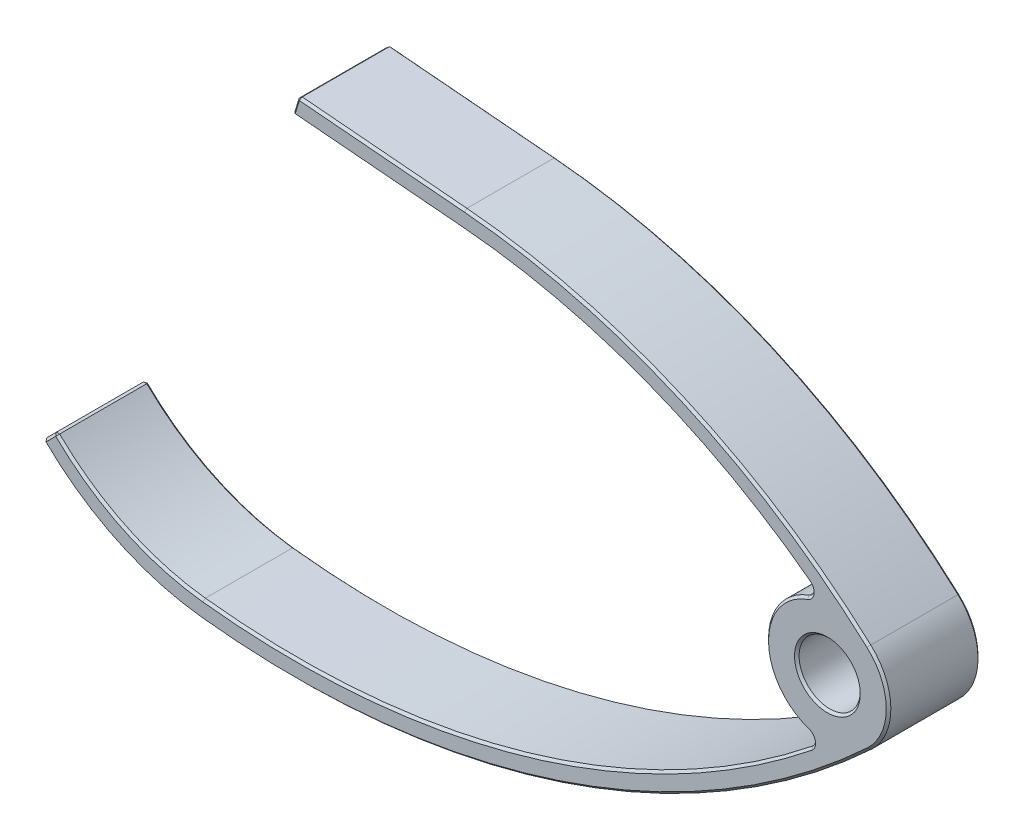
SolidWorks part; units mm, degrees
ref_plane "Спереди" through (0, 0, 0) normal (0, 0, 1) x (1, 0, 0)
ref_plane "Сверху" through (0, 0, 0) normal (0, 1, 0) x (1, 0, 0)
ref_plane "Справа" through (0, 0, 0) normal (1, 0, 0) x (0, 0, -1)
sketch "Эскиз1" plane through (0, 0, 0) normal (0, 0, 1) x (1, 0, 0)
  line L0 (-11.4704, -11.5105) -> (-12.3175, -12.3605)
  line L1 (0, 0) -> (0, -24.7511) construction
  line L2 (4, 14.2504) -> (15.1724, 13.2926)
  line L3 (-12.3175, 0) -> (51.0777, 0) construction
  line L4 (4, 14.2504) -> (4.3545, 15.4244)
  line L5 (5.5763, 15.3197) -> (17.995, 14.255) construction
  line L6 (4.3545, 15.4244) -> (15.2749, 14.4882)
  line L7 (5.5763, 15.3197) -> (5.808, 16.0869) construction
  line L8 (4, 14.2504) -> (4.6592, 16.4337) construction
  line L9 (0, 0) -> (4, 14.2504) construction
  line L10 (19.0603, 12.7831) -> (19.0603, 12.7831)
  line L11 (19.0603, 12.7831) -> (19.0603, 12.7831)
  line L12 (19.0603, 12.7831) -> (19.0603, 12.7831)
  line L13 (4, 14.2504) -> (17.8925, 13.0594) construction
  arc A0 (-11.4704, -11.5105) -> (-1.8309, -16.1465) centre (0, 0) ccw
  circle A1 centre (39, 0) radius 2
  arc A2 (41.727, -2.9263) -> (41.6896, 2.9607) centre (39, 0) ccw
  arc A3 (-1.9661, -17.3389) -> (41.727, -2.9263) centre (4.2308, 37.3109) ccw
  arc A4 (-12.3175, -12.3605) -> (-1.9661, -17.3389) centre (0, 0) ccw
  arc A5 (-1.8309, -16.1465) -> (37.8901, -4.6592) centre (4.2308, 37.3109) ccw
  arc A6 (-3.2729, -15.9632) -> (40.9089, -2.0484) centre (4.2308, 37.3109) ccw construction
  arc A7 (-3.4403, -17.1515) -> (41.727, -2.9263) centre (4.2308, 37.3109) ccw construction
  circle A8 centre (0, 0) radius 17.45 construction
  circle A9 centre (0, 0) radius 16.25 construction
  arc A10 (37.7857, 4.6366) -> (15.1724, 13.2926) centre (11.4312, -30.3473) ccw
  arc A11 (41.6896, 2.9607) -> (15.2749, 14.4882) centre (11.4312, -30.3473) ccw
  arc A12 (40.8827, 2.0725) -> (19.0603, 12.7831) centre (11.4312, -30.3473) ccw construction
  arc A13 (37.6532, 3.7665) -> (37.7354, -3.7948) centre (39, 0) ccw
  arc A14 (37.8901, -4.6592) -> (37.7354, -3.7948) centre (37.5773, -4.2692) ccw
  arc A15 (37.7857, 4.6366) -> (37.6532, 3.7665) centre (37.4849, 4.2373) cw
  point P43 (38.6317, 3.983)
  dimension "D1" = 32.5
  dimension "D2" = 4
  dimension "D4" = 8
  dimension "D5" = 110
  dimension "D14" = 45
  dimension "D16" = 0.5
  dimension "D3" = 39
  dimension "D8" = 44.9
  dimension "D9" = 4.9
  dimension "D10" = 14.54
  dimension "D11" = 4
  dimension "D12" = 78.1
  dimension "D6" = 1.2
  dimension "D7" = 1.2
  dimension "D13" = 1.2
  dimension "D15" = 1.2
extrude "Бобышка-Вытянуть1" add sketch "Эскиз1" along normal blind 6 contours A10 A15 A13 A14 A5 A0 L0 A4 A3 A2 A11 L6 L4 L2 A1
chamfer "Фаска1" distance 0.15 angle 45 34 edges at (4.3545, 15.4244, 3) (4, 14.2504, 3) (41, 0, 0) (-11.4704, -11.5105, 3) (37.9792, 4.162, 0) (35.0002, -0.0434, 0) (38.0695, -4.1811, 0) (19.1772, -14.3712, 0) (-7.043, -14.6444, 0) (-11.8939, -11.9355, 0) (27.0891, 10.5583, 0) (9.5862, 13.7715, 0) (4.1772, 14.8374, 0) (9.8147, 14.9563, 0) (29.4301, 10.8963, 0) (42.9999, 0.0254, 0) (21.4599, -14.9209, 0) (-7.5631, -15.7258, 0) (-12.3175, -12.3605, 3) (9.5862, 13.7715, 6) (4.1772, 14.8374, 6) (9.8147, 14.9563, 6) (29.4301, 10.8963, 6) (42.9999, 0.0254, 6) (21.4599, -14.9209, 6) (-7.5631, -15.7258, 6) (-11.8939, -11.9355, 6) (-7.043, -14.6444, 6) (19.1772, -14.3712, 6) (38.0695, -4.1811, 6) (35.0002, -0.0434, 6) (37.9792, 4.162, 6) (27.0891, 10.5583, 6) (41, 0, 6)
